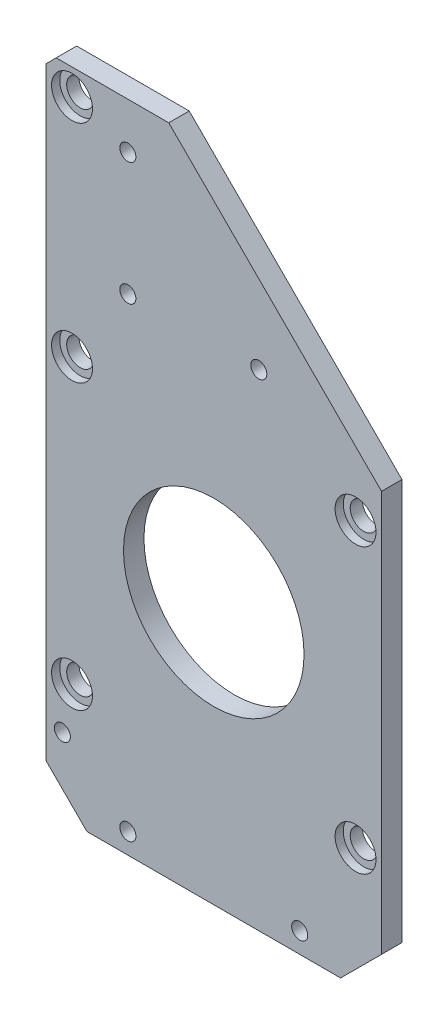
SolidWorks part; units mm, degrees
ref_plane "Front" through (0, 0, 0) normal (0, 0, 1) x (1, 0, 0)
ref_plane "Top" through (0, 0, 0) normal (0, 1, 0) x (1, 0, 0)
ref_plane "Right" through (0, 0, 0) normal (1, 0, 0) x (0, 0, -1)
imported_body "Imported1"
other "DeleteFace1" [suppressed]
sketch "Sketch1" plane through (0, 0, -2.3813) normal (0, 0, -1) x (-1, 0, 0)
  circle A0 centre (0, -22.86) radius 14.0081
  dimension "D1" = 28.0162
extrude "Cut-Extrude1" cut sketch "Sketch1" against normal through all
